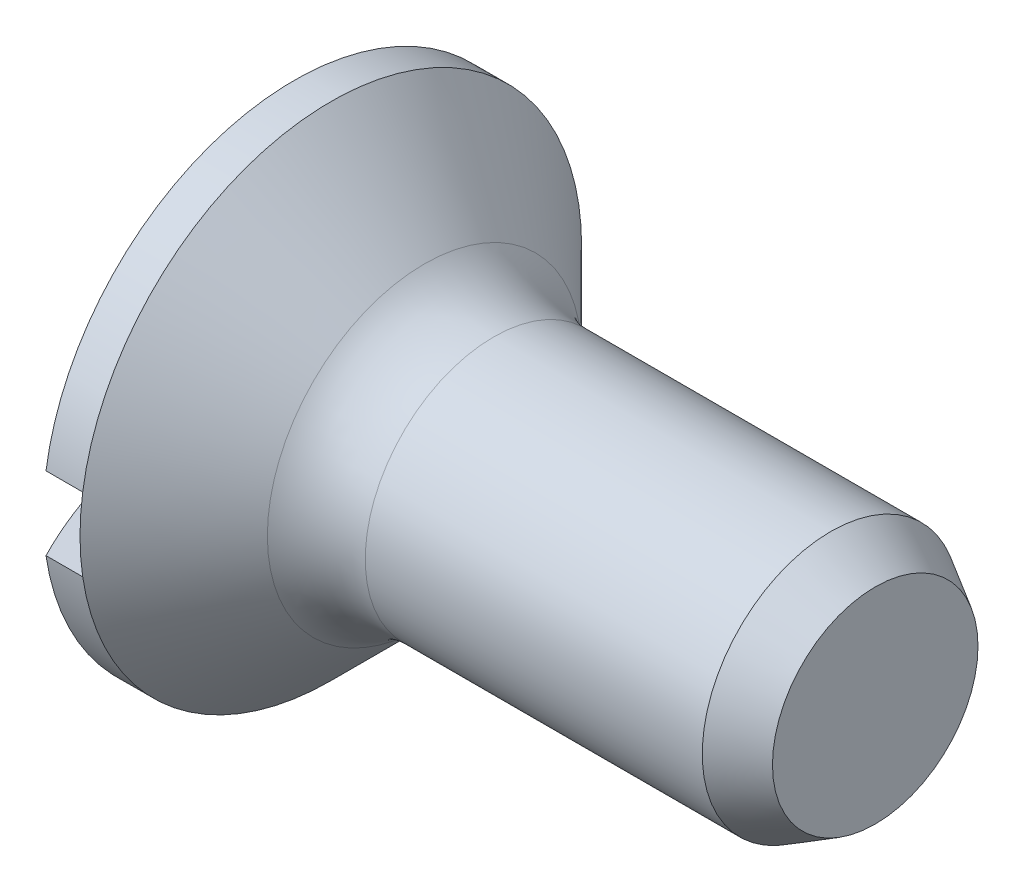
SolidWorks part; units mm, degrees
ref_plane "Front" through (0, 0, 0) normal (0, 0, 1) x (1, 0, 0)
ref_plane "Top" through (0, 0, 0) normal (0, 1, 0) x (1, 0, 0)
ref_plane "Right" through (0, 0, 0) normal (1, 0, 0) x (0, 0, -1)
sketch "Sketch1" plane through (0, 0, 0) normal (0, 0, 1) x (1, 0, 0)
  line L0 (0, 4.1) -> (0.6, 4.1)
  line L1 (0.6, 4.1) -> (2.6, 2.1)
  line L2 (2.6, 2.1) -> (9.5, 2.1)
  line L3 (9.5, 2.1) -> (9.5, 0)
  line L4 (9.5, 0) -> (0, 0)
  line L5 (0, 0) -> (0, 4.1) construction
  line L6 (6.6207, 0) -> (-1, 0) construction
  line L7 (-1, 0) -> (-1, -0.1422) construction
  line L8 (0, 0) -> (-1, 0)
  arc A1 (0, 4.1) -> (-1, 0) centre (7.905, 0) ccw
  dimension "D1" = 45
  dimension "d" = 4.2
  dimension "dK" = 8.2
  dimension "k" = 2.6
  dimension "l" = 9.5
  dimension "f" = 1
revolve "Revolve1" add sketch "Sketch1" angle 360 about L6
sketch "Sketch2" plane through (0, 0, 0) normal (0, 0, 1) x (1, 0, 0)
  line L1 (-1, 0.6) -> (0.6, 0.6)
  line L2 (-1, 0.6) -> (-1, -0.6)
  line L3 (-1, -0.6) -> (0.6, -0.6)
  line L4 (0.6, 0.6) -> (0.6, -0.6)
  line L5 (0, 0) -> (-1, 0) construction
  arc A0 (0, 4.1) -> (-1, 0) centre (7.905, 0) ccw construction
  dimension "n" = 1.2
  dimension "t" = 1.6
extrude "Cut-Extrude1" cut sketch "Sketch2" against normal through all and the other way through all
chamfer "Chamfer1" distance 0.42 angle 60 1 edges at (9.5, 2.1, 0)
sketch "Sketch4" plane through (0, 0, 0) normal (0, 0, 1) x (1, 0, 0)
  line L0 (3.8225, 1.55) -> (3.0575, 1.55)
  line L1 (3.0575, 1.55) -> (2.74, 2.1)
  line L2 (3.8225, 1.55) -> (4.14, 2.1)
  line L3 (2.74, 2.1) -> (2.74, 2.35)
  line L4 (4.14, 2.1) -> (4.14, 2.35)
  line L5 (2.74, 2.35) -> (4.14, 2.35)
  line L6 (3.44, 1.55) -> (3.44, 0) construction
  line L7 (0, 0) -> (7.3035, 0) construction
  line L9 (2.6, 2.1) -> (2.6, -2.1) construction
  line L12 (8.7725, 2.1) -> (2.6, 2.1) construction
  dimension "D2" = 60
  dimension "D3" = 0.25
  dimension "threadstart" = 0.84
  dimension "minordia" = 3.1
  dimension "advance" = 1.4
revolve "ThreadSchematic" [suppressed] cut sketch "Sketch4" angle 360 about L7
pattern_linear "ThdSchPat" [suppressed] count 5 spacing 1.4 along (-1, 0, 0)
sketch "Sketch3" plane through (0, 0, 0) normal (0, 0, 1) x (1, 0, 0)
  line L0 (2.6, 2.1) -> (9.5, 2.1) construction
  line L2 (5.8, 2.1) -> (6.725, 2.1) construction
  line L3 (9.5, 2.1) -> (9.5, 0) construction
  line L4 (6.725, 2.1) -> (9.5, 0)
  line L5 (2.9, 0) -> (5.4301, 0) construction
  line L6 (9.5, 0) -> (9.7, 0)
  line L7 (9.7, 0) -> (9.7, 2.1)
  line L8 (9.7, 2.1) -> (9.5, 2.1)
  line L9 (6.725, 2.1) -> (9.5, 2.1)
  dimension "D1" = 0.925
  dimension "y" = 3.7
  dimension "D2" = 0.2
revolve "EndCone" [suppressed] cut sketch "Sketch3" angle 360 about L5
fillet "Fillet1" radius 1.6 1 edges at (2.6, 2.1, 0)
equation "\"Minordia@sketch4\" = \"D2@ThreadCosmetic\""
equation "\"D1@Chamfer1\" = \"d@Sketch1\" / 10"
equation "\"D1@Sketch3\" = \"y@Sketch3\" / 4"
equation "\"threadstart@Sketch4\" = \"advance@Sketch4\"*0.6"
equation "\"D1@ThdSchPat\" = int(((\"l@Sketch1\"-\"k@Sketch1\")/\"advance@Sketch4\") + 0.999)"
equation "\"D3@ThdSchPat\" = \"advance@Sketch4\""
